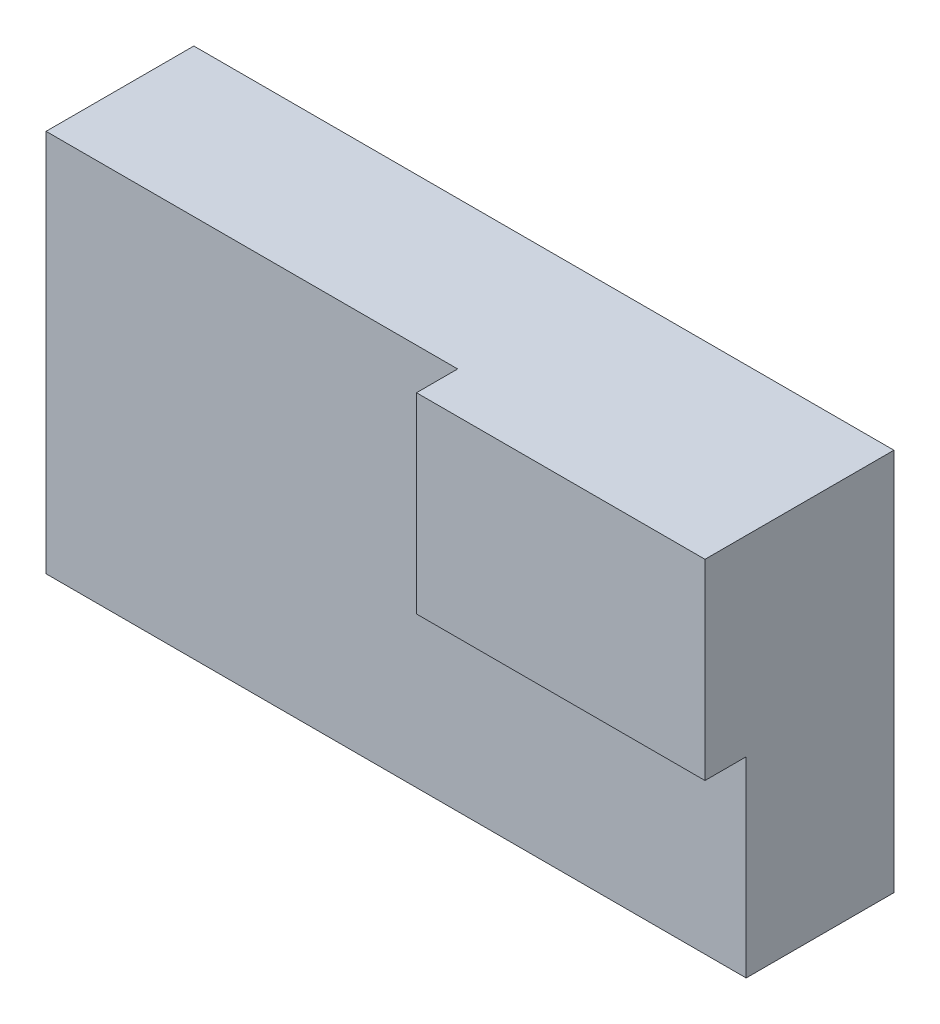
SolidWorks part; units mm, degrees
ref_plane "Front Plane" through (0, 0, 0) normal (0, 0, 1) x (1, 0, 0)
ref_plane "Top Plane" through (0, 0, 0) normal (0, 1, 0) x (1, 0, 0)
ref_plane "Right Plane" through (0, 0, 0) normal (1, 0, 0) x (0, 0, -1)
sketch "Sketch1" plane through (0, 0, 0) normal (0, 0, 1) x (1, 0, 0)
  line L0 (85.0124, -46.5334) -> (-85.0124, 46.5334) construction
  line L1 (-85.0124, 46.5334) -> (85.0124, 46.5334)
  line L2 (-85.0124, 46.5334) -> (-85.0124, -46.5334)
  line L3 (-85.0124, -46.5334) -> (85.0124, -46.5334)
  line L4 (85.0124, 46.5334) -> (85.0124, -46.5334)
extrude "Extrude1" add sketch "Sketch1" along normal blind 35.8868
ref_plane "Plane1" through (0, 0, -80) normal (0, 0, 1) x (1, 0, 0)
sketch "Sketch3" plane through (0, 0, -80) normal (0, 0, 1) x (1, 0, 0)
  line L1 (85.0124, 46.5334) -> (14.9505, 46.5334)
  line L2 (85.0124, 46.5334) -> (85.0124, 0)
  line L3 (85.0124, 0) -> (14.9505, 0)
  line L4 (14.9505, 46.5334) -> (14.9505, 0)
extrude "Boss-Extrude2" add sketch "Sketch3" along normal blind 10 from vertex at 115.8868
